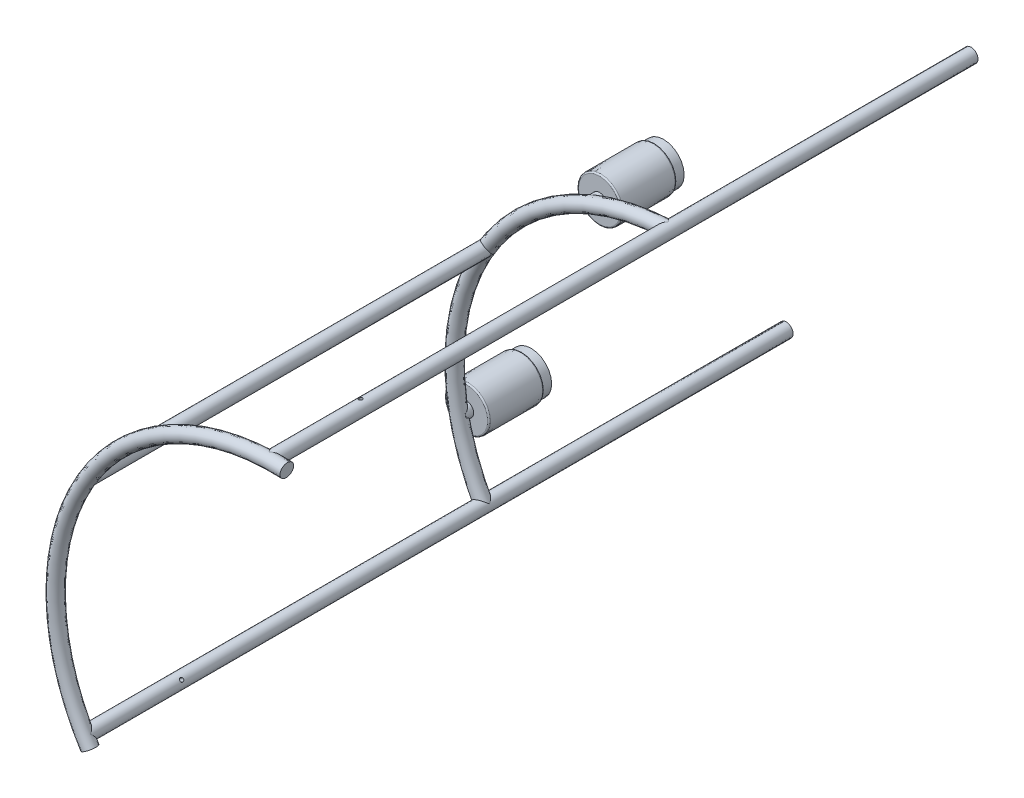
SolidWorks part; units mm, degrees
ref_plane "Plan de face" through (0, 0, 0) normal (0, 0, 1) x (1, 0, 0)
ref_plane "Plan de dessus" through (0, 0, 0) normal (0, 1, 0) x (1, 0, 0)
ref_plane "Plan de droite" through (0, 0, 0) normal (1, 0, 0) x (0, 0, -1)
sketch "Esquisse1" plane through (0, 0, 0) normal (0, 0, 1) x (1, 0, 0)
  line L0 (-15.4445, 481.7525) -> (0, 0) construction
  line L1 (0, 0) -> (-418.6969, -238.7822) construction
  line L4 (0, 0) -> (0, 482) construction
  line L5 (0, 0) -> (22, 481.4977) construction
  line L6 (0, 0) -> (-452.086, -167.1592) construction
  arc A4 (22, 481.4977) -> (-418.6969, -238.7822) centre (0, 0) ccw
  arc A5 (-418.6969, -238.7822) -> (-407.3648, -257.6391) centre (0, 0) ccw
  dimension "D1" = 482
  dimension "D3" = 22
  dimension "D4" = 22
  dimension "D2" = 117.86
ref_plane "Plan2" through (-15.4445, 481.7525, 0) normal (-0.8687, -0.4954, 0) x (0.4954, -0.8687, 0)
sketch "Esquisse9" plane through (0, 0, 0) normal (0, 0, 1) x (1, 0, 0)
  circle A0 centre (-418.6969, -238.7822) radius 15
  circle A1 centre (-15.4445, 481.7525) radius 15
  dimension "D1" = 30
  dimension "D2" = 30
ref_plane "Plan6" through (0, 0, -870) normal (0, 0, 1) x (1, 0, 0)
sketch "Esquisse10" plane through (0, 0, -870) normal (0, 0, 1) x (1, 0, 0)
  line L0 (0, 0) -> (-15.4445, 481.7525) construction
  line L1 (0, 0) -> (-418.6969, -238.7822) construction
  arc A2 (-15.4445, 481.7525) -> (-418.6969, -238.7822) centre (0, 0) ccw
sketch "Esquisse13" plane through (0, 0, 0) normal (0, 0, 1) x (1, 0, 0)
  line L0 (0, 0) -> (-411.1482, 251.5574) construction
  arc A1 (22, 481.4977) -> (-418.6969, -238.7822) centre (0, 0) ccw construction
  circle A2 centre (-411.1482, 251.5574) radius 15
  dimension "D1" = 30
ref_plane "Plan8" through (-418.6969, -238.7822, -870) normal (0.4954, -0.8687, 0) x (0.8687, 0.4954, 0)
sketch "Esquisse16" plane through (-418.6969, -238.7822, -870) normal (0.4954, -0.8687, 0) x (0.8687, 0.4954, 0)
  line L0 (482, 0) -> (0, 0) construction
  line L1 (707.2434, 0) -> (0, 0) construction
  circle A0 centre (0, 0) radius 15
  dimension "D1" = 30
ref_plane "Plan9" through (0, 0, 15) normal (0, 0, 1) x (1, 0, 0)
ref_plane "Plan10" through (-407.3648, -257.6391, 0) normal (0.4954, -0.8687, 0) x (0.8687, 0.4954, 0)
sketch "Esquisse18" plane through (-407.3648, -257.6391, 0) normal (0.4954, -0.8687, 0) x (0.8687, 0.4954, 0)
  circle A0 centre (0, 0) radius 15
  dimension "D1" = 30
sweep "Balayage5" add profiles "Esquisse18" path "Esquisse1"
sweep "Balayage6" add profiles "Esquisse16" path "Esquisse10"
extrude "Extrusion8" add sketch "Esquisse9" against normal blind 1530
extrude "Extrusion9" add sketch "Esquisse13" against normal blind 870
ref_plane "Plan11" through (0, 0, -710) normal (0, 0, 1) x (1, 0, 0)
ref_plane "Plan12" through (-31.861, 2.9172, 0) normal (0.9958, -0.0912, 0) x (0, 0, -1)
sketch "Esquisse19" plane through (0, 0, 0) normal (0, 1, 0) x (1, 0, 0)
  line L0 (-15.6485, 0) -> (-14.2803, 0) construction
  line L1 (-30.4445, 855.017) -> (-30.4445, 14.983) construction
  circle A0 centre (-17.4445, 200) radius 4
  point P2 (-30.4445, 14.8696)
  dimension "D1" = 8
  dimension "D2" = 200
  dimension "D3" = 13
extrude "Enlèv. mat.-Extru.2" cut sketch "Esquisse19" along normal through all
sketch "Esquisse21" plane through (-388.2866, -243.9513, 0) normal (0.8467, 0.532, 0) x (0, 0, -1)
  circle A0 centre (200, 22.5555) radius 4
  dimension "D1" = 8
extrude "Enlèv. mat.-Extru.3" cut sketch "Esquisse21" against normal blind 150
sketch "Esquisse22" plane through (0, 0, -870) normal (0, 0, 1) x (1, 0, 0)
  line L0 (0, 0) -> (-253.9325, 617.0945) construction
  line L1 (0, 0) -> (-636.2218, -126.356) construction
  line L2 (0, 0) -> (0, 676.7461) construction
  circle A0 centre (-183.2291, 445.2745) radius 15
  circle A1 centre (-472.276, -93.7957) radius 15
  dimension "D3" = 30
  dimension "D4" = 30
  dimension "D5" = 481.5
  dimension "D6" = 481.5
  dimension "D1" = 78.866
  dimension "D2" = 22.367
extrude "Extrusion10" add sketch "Esquisse22" against normal blind 17
sketch "Esquisse23" plane through (0, 0, -887) normal (0, 0, -1) x (-1, 0, 0)
  circle A0 centre (472.276, -93.7957) radius 48.5
  circle A1 centre (183.2291, 445.2745) radius 48.5
  dimension "D1" = 97
  dimension "D2" = 97
extrude "Extrusion11" add sketch "Esquisse23" along normal blind 120
sketch "Esquisse24" plane through (0, 0, -1007) normal (0, 0, -1) x (-1, 0, 0)
  circle A0 centre (472.276, -93.7957) radius 45
  circle A1 centre (183.2291, 445.2745) radius 45
  dimension "D1" = 90
  dimension "D2" = 90
extrude "Extrusion12" add sketch "Esquisse24" along normal blind 20
fillet "Congé1" radius 3 4 edges at (-231.7291, 445.2745, -1007) (-231.7291, 445.2745, -887) (-520.776, -93.7957, -1007) (-520.776, -93.7957, -887)
